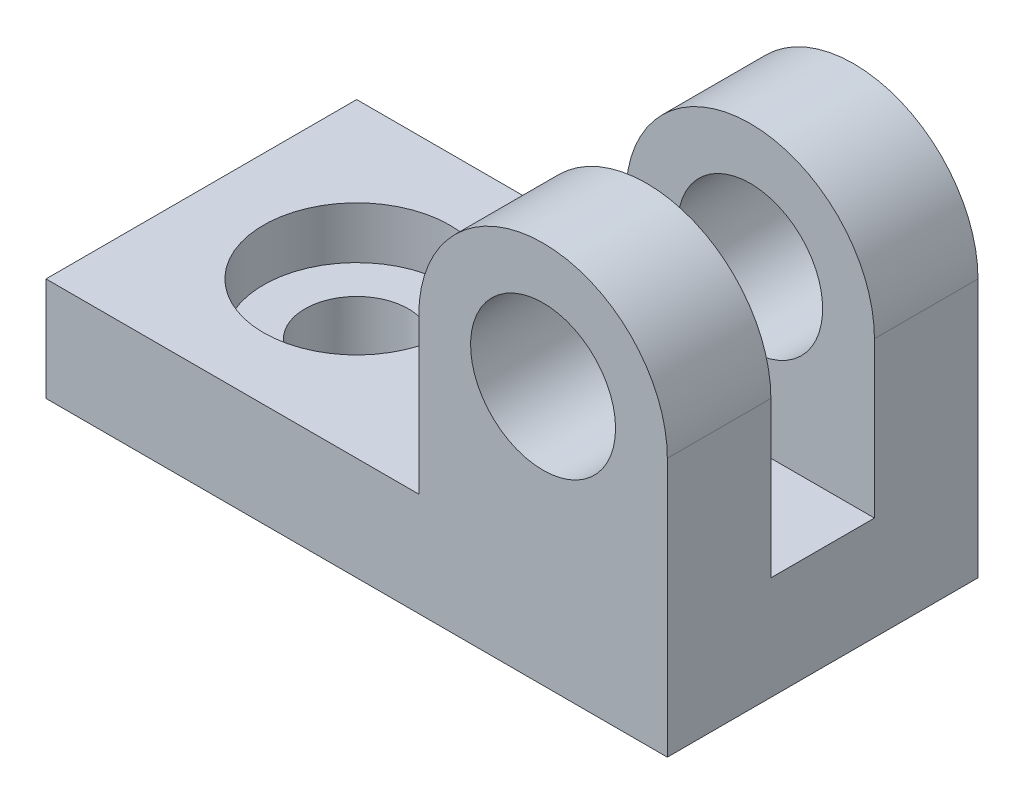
SolidWorks part; units mm, degrees
ref_plane "前视基准面" through (0, 0, 0) normal (0, 0, 1) x (1, 0, 0)
ref_plane "上视基准面" through (0, 0, 0) normal (0, 1, 0) x (1, 0, 0)
ref_plane "右视基准面" through (0, 0, 0) normal (1, 0, 0) x (0, 0, -1)
sketch "草图1" plane through (0, 0, 0) normal (0, 0, 1) x (1, 0, 0)
  line L0 (-82.3632, 0) -> (83.4838, 0) construction
  line L1 (-15.0956, 91.1412) -> (-15.0956, -81.4294) construction
  line L2 (-55.0956, 5) -> (4.9044, 5)
  line L3 (4.9044, -5) -> (-55.0956, -5)
  line L4 (-55.0956, -5) -> (-55.0956, 5)
  line L5 (4.9044, -5) -> (4.9044, 5)
  dimension "D1" = 5
  dimension "D2" = 10
  dimension "D3" = 60
  dimension "D4" = 40
  dimension "D5" = 60
extrude "拉伸1" add sketch "草图1" along normal mid plane 30
sketch "草图2" plane through (0, 0, 0) normal (0, 1, 0) x (1, 0, 0)
  line L0 (-40.0956, 8.3512) -> (-40.0956, -36.5686) construction
  line L1 (-55.0956, -15) -> (-55.0956, 15) construction
  line L2 (-58.2061, 0) -> (7.7475, 0) construction
  line L3 (4.9044, 15) -> (-55.0956, 15) construction
  circle A0 centre (-40.0956, 0) radius 5
  point P8 (-40.0956, 0)
  point P9 (-40.0956, 0)
  dimension "D3" = 10
  dimension "D1" = 15
  dimension "D2" = 15
extrude "切除-拉伸2" cut sketch "草图2" against normal mid plane 30
sketch "草图3" plane through (0, 0, 0) normal (0, 1, 0) x (1, 0, 0)
  circle A0 centre (-40.0956, 0) radius 9
  dimension "D1" = 18
extrude "切除-拉伸3" cut sketch "草图3" along normal up to surface (5 mm away)
sketch "草图4" plane through (0, 0, 0) normal (0, 0, 1) x (1, 0, 0)
  line L0 (-7.0956, 23.262) -> (-7.0956, -20.5882) construction
  line L1 (4.9044, -5) -> (4.9044, 5) construction
  line L2 (-17.4753, 20) -> (5.6976, 20) construction
  line L3 (-55.0956, -5) -> (4.9044, -5) construction
  line L4 (4.9044, 5) -> (4.9044, 20)
  line L5 (-19.0956, 20) -> (-19.0956, 5)
  line L6 (4.9044, 5) -> (-55.0956, 5) construction
  line L7 (-19.0956, 5) -> (4.9044, 5)
  circle A0 centre (-7.0956, 20) radius 7
  arc A1 (4.9044, 20) -> (-19.0956, 20) centre (-7.0956, 20) ccw
  point P8 (-7.0956, 20)
  point P9 (-7.0956, 20)
  dimension "D3" = 14
  dimension "D1" = 12
  dimension "D2" = 25
extrude "拉伸3" add sketch "草图4" along normal mid plane 30
sketch "草图6" plane through (0, 0, 0) normal (1, 0, 0) x (0, 0, -1)
  line L0 (-5, 35.2588) -> (-5, 5)
  line L1 (-5, 5) -> (5, 5)
  line L2 (5, 5) -> (5, 35.2588)
  line L3 (5, 35.2588) -> (-5, 35.2588)
  line L4 (0, 91.1412) -> (0, -81.4294) construction
  line L5 (-15, -5) -> (15, -5) construction
  dimension "D1" = 5
  dimension "D2" = 5
  dimension "D3" = 10
extrude "切除-拉伸4" cut sketch "草图6" against normal mid plane 50
